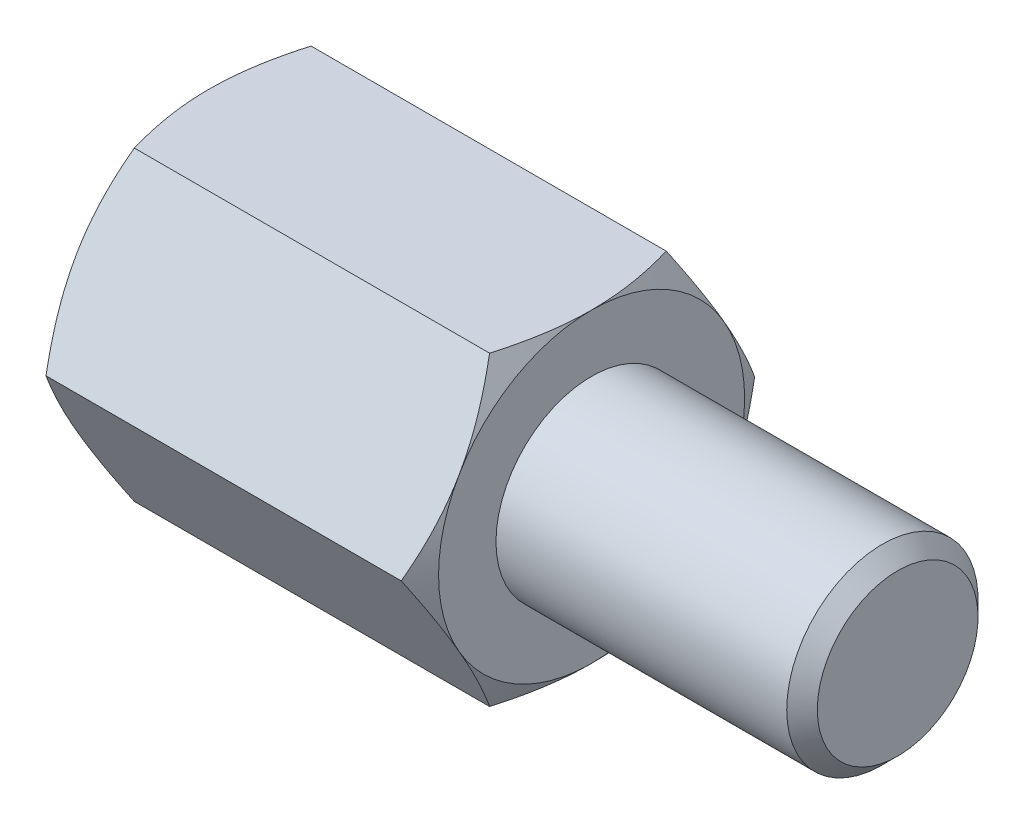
SolidWorks part; units mm, degrees
ref_plane "Front Plane" through (0, 0, 0) normal (0, 0, 1) x (1, 0, 0)
ref_plane "Top Plane" through (0, 0, 0) normal (0, 1, 0) x (1, 0, 0)
ref_plane "Right Plane" through (0, 0, 0) normal (1, 0, 0) x (0, 0, -1)
sketch "Sketch1" plane through (0, 0, 0) normal (1, 0, 0) x (0, 0, -1)
  line L1 (2.3094, 4) -> (-2.3094, 4)
  line L2 (-2.3094, 4) -> (-4.6188, 0)
  line L3 (-4.6188, 0) -> (-2.3094, -4)
  line L4 (-2.3094, -4) -> (2.3094, -4)
  line L5 (2.3094, -4) -> (4.6188, 0)
  line L6 (4.6188, 0) -> (2.3094, 4)
  circle A0 centre (0, 0) radius 4 construction
  dimension "D1" = 8
extrude "Extrude2" add sketch "Sketch1" along normal mid plane 10
sketch "Sketch2" plane through (0, 0, 0) normal (0, 0, 1) x (1, 0, 0)
  line L0 (-5, 4) -> (-3.5, 6.5981)
  line L1 (-5, 7) -> (-5, 4)
  line L3 (0, 0) -> (50000, 0) construction
  arc A0 (-3.5, 6.5981) -> (-5, 7) centre (-4.1962, 7) ccw
  dimension "D1" = 30
  dimension "D2" = 3
revolve "Cut-Revolve1" cut sketch "Sketch2" angle 360 about L3
mirror "Mirror1" about plane through (0, 0, 0) normal (1, 0, 0) of "Cut-Revolve1"
sketch "Sketch3" plane through (-5, 0, 0) normal (-1, 0, 0) x (0, 0, 1)
  circle A0 centre (0, 0) radius 2.1
  dimension "D1" = 4.2
extrude "Extrude3" cut sketch "Sketch3" against normal blind 5
sketch "Sketch4" plane through (0, 0, 0) normal (0, 0, 1) x (1, 0, 0)
  line L0 (0, 0) -> (0, 2.1)
  line L1 (4.6427, 0) -> (-4.6427, 0) construction
  line L2 (0, 2.1) -> (1.2124, 0)
  line L3 (1.2124, 0) -> (0, 0)
  line L4 (-5, 2) -> (-5, -2) construction
  point P4 (-5, 0)
  dimension "D1" = 30
  dimension "D2" = 2.1
  dimension "D3" = 5
revolve "Cut-Revolve2" cut sketch "Sketch4" angle 360 about L3
sketch "Sketch5" plane through (5, 0, 0) normal (1, 0, 0) x (0, 0, -1)
  circle A0 centre (0, 0) radius 2.5
  dimension "D1" = 5
extrude "Extrude4" add sketch "Sketch5" along normal blind 8
chamfer "Chamfer1" distance 0.4 angle 45 1 edges at (13, 0, -2.5)
equation "\"D2@Sketch4\" = \"D1@Sketch3\"/2"
